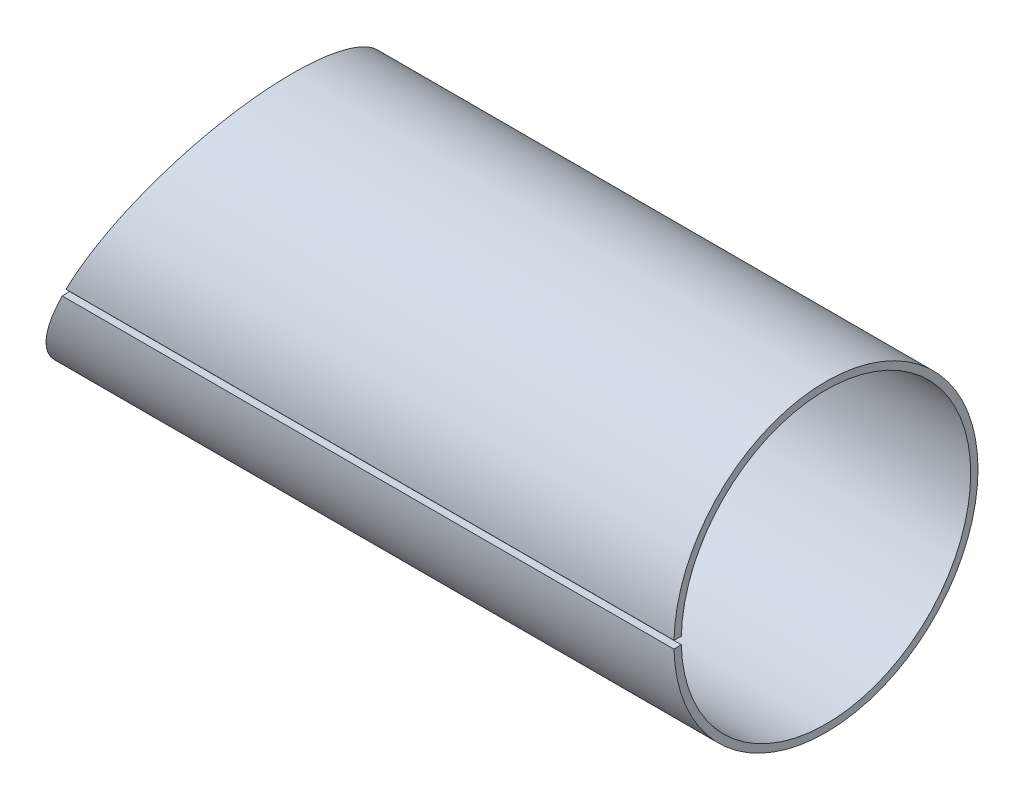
SolidWorks part; units mm, degrees
ref_plane "前视基准面" through (0, 0, 0) normal (0, 0, 1) x (1, 0, 0)
ref_plane "上视基准面" through (0, 0, 0) normal (0, 1, 0) x (1, 0, 0)
ref_plane "右视基准面" through (0, 0, 0) normal (1, 0, 0) x (0, 0, -1)
imported_body "基体零件-双扭向90°和任意角度蛇形弯管-1"
sheet metal parameters "钣金1" parameters "D1"=0.7366, "厚度"=1
bend "圆角折弯1" bend radius 19.786 bend angle 357.104 parameters "D5"=1
flatten bends "展开-折弯1" parameters "D1"=0
sketch "尖角-草图1" plane through (41.8249, 0.5, 19.7797) normal (0, -0.0253, -0.9997) x (-1, 0, 0)
  line L0 (41.8249, 61.6596) -> (-41.5612, 61.6596) construction
process bends "加工-折弯1" parameters "D1"=0
sketch "平面-草图1" plane through (0, 0.5, 19.7797) normal (0, -0.0253, -0.9997) x (-1, 0, 0)
